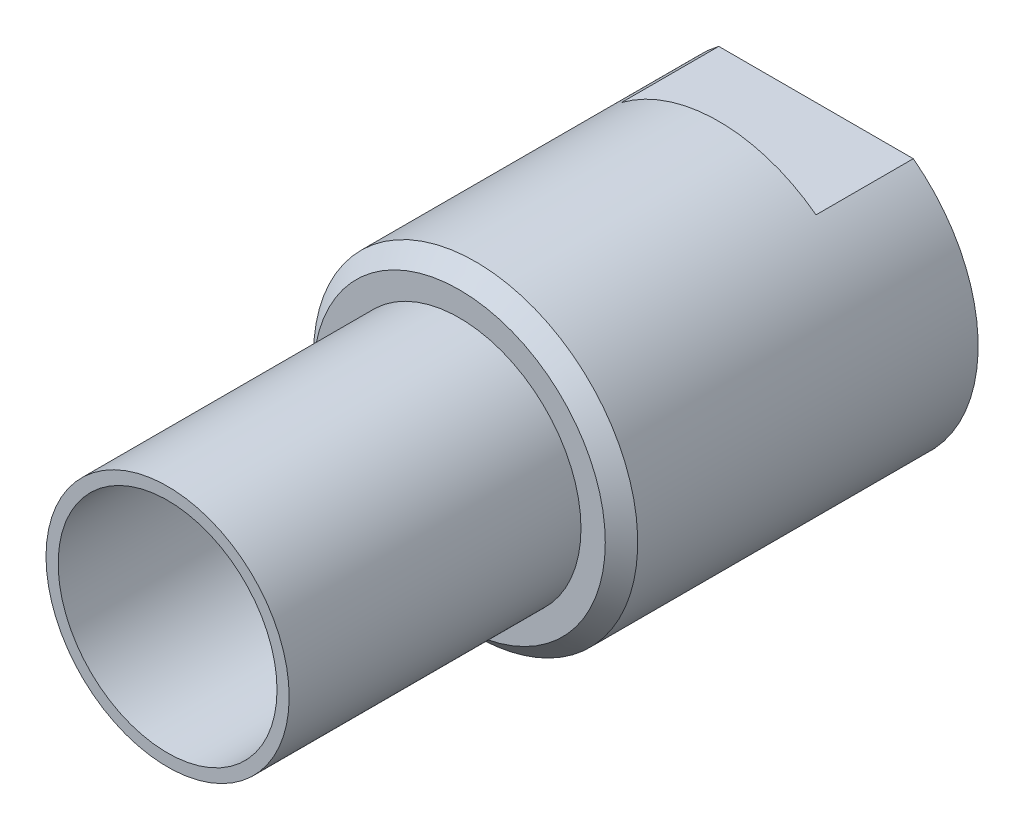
SolidWorks part; units mm, degrees
ref_plane "Plan de face" through (0, 0, 0) normal (0, 0, 1) x (1, 0, 0)
ref_plane "Plan de dessus" through (0, 0, 0) normal (0, 1, 0) x (1, 0, 0)
ref_plane "Plan de droite" through (0, 0, 0) normal (1, 0, 0) x (0, 0, -1)
sketch "Esquisse1" plane through (0, 0, 0) normal (0, 0, 1) x (1, 0, 0)
  circle A0 centre (0, 0) radius 7.5
extrude "Boss.-Extru.1" add sketch "Esquisse1" along normal blind 18
sketch "Esquisse2" plane through (0, 0, 0) normal (0, 0, -1) x (-1, 0, 0)
  circle A0 centre (0, 0) radius 10
extrude "Boss.-Extru.2" add sketch "Esquisse2" along normal blind 22
sketch "Esquisse3" plane through (0, 0, -22) normal (0, 0, -1) x (-1, 0, 0)
  circle A0 centre (0, 0) radius 4
extrude "Enlèv. mat.-Extru.1" cut sketch "Esquisse3" against normal blind 41
chamfer "Chanfrein1" distance 1 angle 45 1 edges at (-10, 0, 0)
sketch "Esquisse7" plane through (0, 0, 18) normal (0, 0, 1) x (1, 0, 0)
  circle A0 centre (0, 0) radius 6.75
  dimension "D1" = 13.5
extrude "Enlèv. mat.-Extru.7" cut sketch "Esquisse7" against normal blind 10
sketch "Esquisse8" plane through (0, 0, -22) normal (0, 0, -1) x (-1, 0, 0)
  line L1 (-11.6876, 8) -> (13.234, 8)
  line L2 (-11.6876, 8) -> (-11.6876, 10.2296)
  line L3 (-11.6876, 10.2296) -> (13.234, 10.2296)
  line L4 (13.234, 8) -> (13.234, 10.2296)
  line L5 (10.2851, -11.2725) -> (-12.5148, -11.2725)
  line L6 (10.2851, -11.2725) -> (10.2851, -8)
  line L7 (10.2851, -8) -> (-12.5148, -8)
  line L8 (-12.5148, -11.2725) -> (-12.5148, -8)
  dimension "D1" = 16
  dimension "D2" = 8
extrude "Enlèv. mat.-Extru.8" cut sketch "Esquisse8" against normal blind 6
